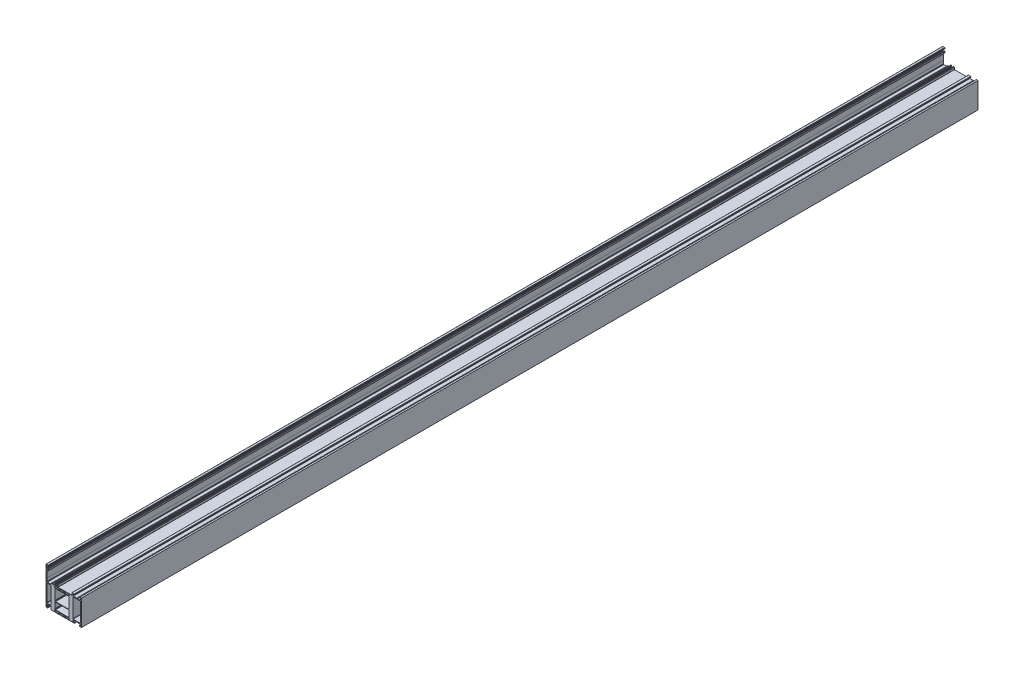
SolidWorks part; units mm, degrees
ref_plane "Ebene vorne" through (0, 0, 0) normal (0, 0, 1) x (1, 0, 0)
ref_plane "Ebene oben" through (0, 0, 0) normal (0, 1, 0) x (1, 0, 0)
ref_plane "Ebene rechts" through (0, 0, 0) normal (1, 0, 0) x (0, 0, -1)
sketch "Skizze1" plane through (0, 0, 0) normal (0, 0, 1) x (1, 0, 0)
  line L0 (15.4, 49) -> (16.2002, 49.0012)
  line L5 (1.85, 45.533) -> (1.9706, 45.583)
  line L6 (28.9408, 47.4176) -> (28.9038, 47.3119)
  line L7 (25.3003, 49.0607) -> (25.3415, 49.0285)
  line L8 (25.3415, 49.0285) -> (25.3896, 49.0079)
  line L9 (25.3896, 49.0079) -> (25.4414, 49.0001)
  line L10 (18.5413, 47.7007) -> (18.43, 47.6881)
  line L11 (47.2413, 44.1006) -> (20.2413, 44.1006)
  line L12 (20.2413, 44.1006) -> (19.9075, 44.063)
  line L13 (19.9075, 44.063) -> (19.5905, 43.9521)
  line L14 (19.5905, 43.9521) -> (19.3061, 43.7734)
  line L15 (19.3061, 43.7734) -> (19.0685, 43.5359)
  line L16 (19.0685, 43.5359) -> (18.8898, 43.2515)
  line L17 (18.8898, 43.2515) -> (18.7789, 42.9344)
  line L18 (18.7789, 42.9344) -> (18.7413, 42.6006)
  line L19 (18.7413, 42.6006) -> (18.7413, 21.6006)
  line L20 (1.6, 27) -> (1.6, 8.9)
  line L21 (1.6, 8.9) -> (1.6125, 8.7888)
  line L22 (1.6125, 8.7888) -> (1.6495, 8.6831)
  line L23 (1.6495, 8.6831) -> (1.7091, 8.5883)
  line L24 (1.7091, 8.5883) -> (1.7883, 8.5091)
  line L25 (1.7883, 8.5091) -> (1.8831, 8.4495)
  line L26 (1.8831, 8.4495) -> (1.9887, 8.4125)
  line L27 (1.9887, 8.4125) -> (2.1, 8.4)
  line L28 (2.1, 8.4) -> (10.3, 8.4)
  line L29 (10.3, 8.4) -> (10.4113, 8.4125)
  line L30 (10.4113, 8.4125) -> (10.5169, 8.4495)
  line L31 (10.5169, 8.4495) -> (10.6117, 8.5091)
  line L32 (10.6117, 8.5091) -> (10.6909, 8.5883)
  line L33 (10.6909, 8.5883) -> (10.7505, 8.6831)
  line L34 (10.7505, 8.6831) -> (10.7875, 8.7888)
  line L35 (10.7875, 8.7888) -> (10.8, 8.9)
  line L36 (10.8, 8.9) -> (10.8, 45.1)
  line L37 (10.8, 45.1) -> (10.7875, 45.2113)
  line L38 (10.7875, 45.2113) -> (10.7505, 45.317)
  line L39 (10.7505, 45.317) -> (10.6909, 45.4118)
  line L40 (10.6909, 45.4118) -> (10.6117, 45.4909)
  line L41 (10.6117, 45.4909) -> (10.5169, 45.5505)
  line L42 (10.5169, 45.5505) -> (10.4113, 45.5875)
  line L43 (10.4113, 45.5875) -> (10.3, 45.6)
  line L44 (10.3, 45.6) -> (2.1, 45.6)
  line L45 (2.1, 45.6) -> (1.9706, 45.583)
  line L46 (1.9706, 45.583) -> (1.85, 45.533)
  line L47 (1.85, 45.533) -> (1.7465, 45.4536)
  line L48 (1.7465, 45.4536) -> (1.667, 45.35)
  line L49 (1.667, 45.35) -> (1.617, 45.2294)
  line L50 (1.617, 45.2294) -> (1.6, 45.1)
  line L51 (1.6, 45.1) -> (1.6, 27)
  line L52 (0, 0) -> (0, 39.25)
  line L53 (0, 39.25) -> (0, 78.5)
  line L54 (0, 78.5) -> (0.0125, 78.6113)
  line L55 (0.0125, 78.6113) -> (0.0495, 78.7169)
  line L56 (0.0495, 78.7169) -> (0.1091, 78.8117)
  line L57 (0.1091, 78.8117) -> (0.1883, 78.8909)
  line L58 (0.1883, 78.8909) -> (0.2831, 78.9505)
  line L59 (0.2831, 78.9505) -> (0.3887, 78.9875)
  line L60 (0.3887, 78.9875) -> (0.5, 79)
  line L61 (0.5, 79) -> (4.5, 79)
  line L62 (4.5, 79) -> (4.6113, 78.9875)
  line L63 (4.6113, 78.9875) -> (4.7169, 78.9505)
  line L64 (4.7169, 78.9505) -> (4.8117, 78.8909)
  line L65 (4.8117, 78.8909) -> (4.8909, 78.8117)
  line L66 (4.8909, 78.8117) -> (4.9505, 78.7169)
  line L67 (4.9505, 78.7169) -> (4.9875, 78.6113)
  line L68 (4.9875, 78.6113) -> (5, 78.5)
  line L69 (5, 78.5) -> (5, 77.2)
  line L70 (5, 77.2) -> (4.9875, 77.0887)
  line L71 (4.9875, 77.0887) -> (4.9505, 76.983)
  line L72 (4.9505, 76.983) -> (4.8909, 76.8882)
  line L73 (4.8909, 76.8882) -> (4.8117, 76.8091)
  line L74 (4.8117, 76.8091) -> (4.7169, 76.7495)
  line L75 (4.7169, 76.7495) -> (4.6113, 76.7125)
  line L76 (4.6113, 76.7125) -> (4.5, 76.7)
  line L77 (4.5, 76.7) -> (4, 76.7)
  line L78 (4, 76.7) -> (4, 77.7)
  line L79 (4, 77.7) -> (2.3, 77.7)
  line L80 (2.3, 77.7) -> (2.0412, 77.6659)
  line L81 (2.0412, 77.6659) -> (1.8, 77.566)
  line L82 (1.8, 77.566) -> (1.5929, 77.4071)
  line L83 (1.5929, 77.4071) -> (1.434, 77.2)
  line L84 (1.434, 77.2) -> (1.3341, 76.9588)
  line L85 (1.3341, 76.9588) -> (1.3, 76.7)
  line L86 (1.3, 76.7) -> (1.3, 72.7)
  line L87 (1.3, 72.7) -> (1.3251, 72.4775)
  line L88 (1.3251, 72.4775) -> (1.399, 72.2661)
  line L89 (1.399, 72.2661) -> (1.5182, 72.0765)
  line L90 (1.5182, 72.0765) -> (1.6765, 71.9182)
  line L91 (1.6765, 71.9182) -> (1.8661, 71.799)
  line L92 (1.8661, 71.799) -> (2.0775, 71.7251)
  line L93 (2.0775, 71.7251) -> (2.3, 71.7)
  line L94 (2.3, 71.7) -> (4, 71.7)
  line L95 (4, 71.7) -> (4, 72.7)
  line L96 (4, 72.7) -> (4.5, 72.7)
  line L97 (4.5, 72.7) -> (4.6294, 72.683)
  line L98 (4.6294, 72.683) -> (4.75, 72.633)
  line L99 (4.75, 72.633) -> (4.8535, 72.5536)
  line L100 (4.8535, 72.5536) -> (4.933, 72.45)
  line L101 (4.933, 72.45) -> (4.983, 72.3294)
  line L102 (4.983, 72.3294) -> (5, 72.2)
  line L103 (5, 72.2) -> (5, 69.4)
  line L104 (5, 69.4) -> (4.9875, 69.2887)
  line L105 (4.9875, 69.2887) -> (4.9505, 69.1831)
  line L106 (4.9505, 69.1831) -> (4.8909, 69.0882)
  line L107 (4.8909, 69.0882) -> (4.8117, 69.0091)
  line L108 (4.8117, 69.0091) -> (4.7169, 68.9495)
  line L109 (4.7169, 68.9495) -> (4.6113, 68.9125)
  line L110 (4.6113, 68.9125) -> (4.5, 68.9)
  line L111 (4.5, 68.9) -> (4.3, 68.9)
  line L112 (4.3, 68.9) -> (4.1887, 68.9125)
  line L113 (4.1887, 68.9125) -> (4.0831, 68.9495)
  line L114 (4.0831, 68.9495) -> (3.9883, 69.0091)
  line L115 (3.9883, 69.0091) -> (3.9091, 69.0882)
  line L116 (3.9091, 69.0882) -> (3.8495, 69.1831)
  line L117 (3.8495, 69.1831) -> (3.8125, 69.2887)
  line L118 (3.8125, 69.2887) -> (3.8, 69.4)
  line L119 (3.8, 69.4) -> (3.8, 69.9)
  line L120 (3.8, 69.9) -> (3.783, 70.0294)
  line L121 (3.783, 70.0294) -> (3.733, 70.15)
  line L122 (3.733, 70.15) -> (3.6536, 70.2535)
  line L123 (3.6536, 70.2535) -> (3.55, 70.333)
  line L124 (3.55, 70.333) -> (3.4294, 70.383)
  line L125 (3.4294, 70.383) -> (3.3, 70.4)
  line L126 (3.3, 70.4) -> (2.1, 70.4)
  line L127 (2.1, 70.4) -> (1.9887, 70.3875)
  line L128 (1.9887, 70.3875) -> (1.8831, 70.3505)
  line L129 (1.8831, 70.3505) -> (1.7883, 70.2909)
  line L130 (1.7883, 70.2909) -> (1.7091, 70.2117)
  line L131 (1.7091, 70.2117) -> (1.6495, 70.1169)
  line L132 (1.6495, 70.1169) -> (1.6125, 70.0113)
  line L133 (1.6125, 70.0113) -> (1.6, 69.9)
  line L134 (1.6, 69.9) -> (1.6, 54)
  line L135 (1.6, 54) -> (1.9461, 47.943)
  line L136 (1.9461, 47.943) -> (1.992, 47.6956)
  line L137 (1.992, 47.6956) -> (2.0981, 47.4674)
  line L138 (2.0981, 47.4674) -> (2.2578, 47.273)
  line L139 (2.2578, 47.273) -> (2.461, 47.1246)
  line L140 (2.461, 47.1246) -> (2.6949, 47.0317)
  line L141 (2.6949, 47.0317) -> (2.9445, 47)
  line L142 (2.9445, 47) -> (10.1, 47)
  line L143 (10.1, 47) -> (10.2294, 47.017)
  line L144 (10.2294, 47.017) -> (10.35, 47.067)
  line L145 (10.35, 47.067) -> (10.4536, 47.1464)
  line L146 (10.4536, 47.1464) -> (10.533, 47.25)
  line L147 (10.533, 47.25) -> (10.583, 47.3706)
  line L148 (10.583, 47.3706) -> (10.6, 47.5)
  line L149 (10.6, 47.5) -> (10.6, 48.5)
  line L150 (10.6, 48.5) -> (10.6125, 48.6113)
  line L151 (10.6125, 48.6113) -> (10.6495, 48.7169)
  line L152 (10.6495, 48.7169) -> (10.7091, 48.8117)
  line L153 (10.7091, 48.8117) -> (10.7883, 48.8909)
  line L154 (10.7883, 48.8909) -> (10.8831, 48.9505)
  line L155 (10.8831, 48.9505) -> (10.9887, 48.9875)
  line L156 (10.9887, 48.9875) -> (11.1, 49)
  line L157 (11.1, 49) -> (12.5, 49)
  line L158 (12.5, 49) -> (12.5294, 48.9337)
  line L159 (12.5294, 48.9337) -> (12.5749, 48.8772)
  line L160 (12.5749, 48.8772) -> (12.6335, 48.8343)
  line L161 (12.6335, 48.8343) -> (12.7011, 48.808)
  line L162 (12.7011, 48.808) -> (12.7732, 48.8)
  line L163 (12.7732, 48.8) -> (13.2268, 48.8)
  line L164 (13.2268, 48.8) -> (13.2989, 48.808)
  line L165 (13.2989, 48.808) -> (13.3665, 48.8343)
  line L166 (13.3665, 48.8343) -> (13.4251, 48.8772)
  line L167 (13.4251, 48.8772) -> (13.4706, 48.9337)
  line L168 (13.4706, 48.9337) -> (13.5, 49)
  line L169 (13.5, 49) -> (15.4, 49)
  line L273 (15.3998, 0.1999) -> (13.4999, 0.1999)
  line L274 (13.4999, 0.1999) -> (13.4705, 0.2662)
  line L275 (13.4705, 0.2662) -> (13.4249, 0.3227)
  line L276 (13.4249, 0.3227) -> (13.3664, 0.3656)
  line L277 (13.3664, 0.3656) -> (13.2988, 0.3919)
  line L278 (13.2988, 0.3919) -> (13.2266, 0.3999)
  line L279 (13.2266, 0.3999) -> (12.7731, 0.3999)
  line L280 (12.7731, 0.3999) -> (12.701, 0.3919)
  line L281 (12.701, 0.3919) -> (12.6334, 0.3656)
  line L282 (12.6334, 0.3656) -> (12.5749, 0.3228)
  line L283 (12.5749, 0.3228) -> (12.5295, 0.2663)
  line L284 (12.5295, 0.2663) -> (12.5001, 0.2)
  line L285 (12.5001, 0.2) -> (11, 0.2)
  line L286 (11, 0.2) -> (10.8887, 0.2125)
  line L287 (10.8887, 0.2125) -> (10.7831, 0.2495)
  line L288 (10.7831, 0.2495) -> (10.6883, 0.3091)
  line L289 (10.6883, 0.3091) -> (10.6091, 0.3883)
  line L290 (10.6091, 0.3883) -> (10.5495, 0.4831)
  line L291 (10.5495, 0.4831) -> (10.5125, 0.5888)
  line L292 (10.5125, 0.5888) -> (10.5, 0.7)
  line L293 (10.5, 0.7) -> (10.5, 6.5)
  line L294 (10.5, 6.5) -> (10.4875, 6.6113)
  line L295 (10.4875, 6.6113) -> (10.4505, 6.7169)
  line L296 (10.4505, 6.7169) -> (10.3909, 6.8117)
  line L297 (10.3909, 6.8117) -> (10.3117, 6.8909)
  line L298 (10.3117, 6.8909) -> (10.2169, 6.9505)
  line L299 (10.2169, 6.9505) -> (10.1113, 6.9875)
  line L300 (10.1113, 6.9875) -> (10, 7)
  line L301 (10, 7) -> (2.8, 7)
  line L302 (2.8, 7) -> (2.5412, 6.9659)
  line L303 (2.5412, 6.9659) -> (2.3, 6.866)
  line L304 (2.3, 6.866) -> (2.0929, 6.7071)
  line L305 (2.0929, 6.7071) -> (1.934, 6.5)
  line L306 (1.934, 6.5) -> (1.8341, 6.2588)
  line L307 (1.8341, 6.2588) -> (1.8, 6)
  line L308 (1.8, 6) -> (1.8, 2.7)
  line L309 (1.8, 2.7) -> (1.8251, 2.4775)
  line L310 (1.8251, 2.4775) -> (1.899, 2.2661)
  line L311 (1.899, 2.2661) -> (2.0182, 2.0765)
  line L312 (2.0182, 2.0765) -> (2.1765, 1.9182)
  line L313 (2.1765, 1.9182) -> (2.3661, 1.799)
  line L314 (2.3661, 1.799) -> (2.5775, 1.7251)
  line L315 (2.5775, 1.7251) -> (2.8, 1.7)
  line L316 (2.8, 1.7) -> (4.5, 1.7)
  line L317 (4.5, 1.7) -> (4.5, 1.1)
  line L318 (4.5, 1.1) -> (3.4, 0)
  line L319 (3.4, 0) -> (0, 0)
  line L320 (29.04, 45.5493) -> (29.0795, 45.5097)
  line L321 (29.0795, 45.5097) -> (29.1743, 45.4502)
  line L322 (29.1743, 45.4502) -> (29.28, 45.4132)
  line L323 (29.28, 45.4132) -> (29.3913, 45.4006)
  line L324 (29.3913, 45.4006) -> (38.0913, 45.4006)
  line L325 (38.0913, 45.4006) -> (38.2207, 45.4177)
  line L326 (38.2207, 45.4177) -> (38.3413, 45.4676)
  line L327 (38.3413, 45.4676) -> (38.4448, 45.5471)
  line L328 (38.4448, 45.5471) -> (38.5243, 45.6506)
  line L329 (38.5243, 45.6506) -> (38.5743, 45.7712)
  line L330 (38.5743, 45.7712) -> (38.5913, 45.9006)
  line L331 (38.5913, 45.9006) -> (38.5913, 47.2007)
  line L332 (38.5913, 47.2007) -> (38.5788, 47.3119)
  line L333 (38.5788, 47.3119) -> (38.5418, 47.4176)
  line L334 (38.5418, 47.4176) -> (38.4822, 47.5124)
  line L335 (38.4822, 47.5124) -> (38.403, 47.5916)
  line L336 (38.403, 47.5916) -> (38.3082, 47.6511)
  line L337 (38.3082, 47.6511) -> (38.2026, 47.6881)
  line L338 (38.2026, 47.6881) -> (38.0913, 47.7007)
  line L339 (38.0913, 47.7007) -> (29.3913, 47.7007)
  line L340 (29.3913, 47.7007) -> (29.28, 47.6881)
  line L341 (29.28, 47.6881) -> (29.1743, 47.6511)
  line L342 (29.1743, 47.6511) -> (29.0795, 47.5916)
  line L343 (29.0795, 47.5916) -> (29.0004, 47.5124)
  line L344 (29.0004, 47.5124) -> (28.9408, 47.4176)
  line L345 (28.9408, 47.4176) -> (28.9038, 47.3119)
  line L346 (28.9038, 47.3119) -> (28.8913, 47.2007)
  line L347 (28.8913, 47.2007) -> (28.8913, 45.9006)
  line L348 (28.8913, 45.9006) -> (28.9038, 45.7894)
  line L349 (28.9038, 45.7894) -> (28.9408, 45.6837)
  line L350 (28.9408, 45.6837) -> (29.0004, 45.5889)
  line L351 (29.0004, 45.5889) -> (29.04, 45.5493)
  line L352 (22.9663, 47.7007) -> (18.5413, 47.7007)
  line L353 (18.5413, 47.7007) -> (18.43, 47.6881)
  line L354 (18.43, 47.6881) -> (18.3243, 47.6511)
  line L355 (18.3243, 47.6511) -> (18.2295, 47.5916)
  line L356 (18.2295, 47.5916) -> (18.1504, 47.5124)
  line L357 (18.1504, 47.5124) -> (18.0908, 47.4176)
  line L358 (18.0908, 47.4176) -> (18.0538, 47.3119)
  line L359 (18.0538, 47.3119) -> (18.0413, 47.2007)
  line L360 (18.0413, 47.2007) -> (18.0413, 45.9007)
  line L361 (18.0413, 45.9007) -> (18.0538, 45.7894)
  line L362 (18.0538, 45.7894) -> (18.0908, 45.6837)
  line L363 (18.0908, 45.6837) -> (18.1504, 45.5889)
  line L364 (18.1504, 45.5889) -> (18.2296, 45.5097)
  line L365 (18.2296, 45.5097) -> (18.3244, 45.4502)
  line L366 (18.3244, 45.4502) -> (18.43, 45.4132)
  line L367 (18.43, 45.4132) -> (18.5413, 45.4006)
  line L368 (18.5413, 45.4006) -> (27.3913, 45.4006)
  line L369 (27.3913, 45.4006) -> (27.4469, 45.4069)
  line L370 (27.4469, 45.4069) -> (27.5025, 45.4132)
  line L371 (27.5025, 45.4132) -> (27.6082, 45.4502)
  line L372 (27.6082, 45.4502) -> (27.703, 45.5097)
  line L373 (27.703, 45.5097) -> (27.7822, 45.5889)
  line L374 (27.7822, 45.5889) -> (27.8418, 45.6837)
  line L375 (27.8418, 45.6837) -> (27.8788, 45.7894)
  line L376 (27.8788, 45.7894) -> (27.8913, 45.9006)
  line L377 (27.8913, 45.9006) -> (27.8913, 47.2006)
  line L378 (27.8913, 47.2006) -> (27.8788, 47.3119)
  line L379 (27.8788, 47.3119) -> (27.8418, 47.4176)
  line L380 (27.8418, 47.4176) -> (27.7822, 47.5124)
  line L381 (27.7822, 47.5124) -> (27.703, 47.5916)
  line L382 (27.703, 47.5916) -> (27.6082, 47.6511)
  line L383 (27.6082, 47.6511) -> (27.5026, 47.6881)
  line L384 (27.5026, 47.6881) -> (27.3913, 47.7007)
  line L385 (27.3913, 47.7007) -> (22.9663, 47.7007)
  line L386 (25.4414, 49.0001) -> (38.362, 49.0001)
  line L387 (38.362, 49.0001) -> (44.8224, 49.0001)
  line L388 (44.8224, 49.0001) -> (52.1201, 49.0001)
  line L424 (47.2451, 44.1002) -> (33.7413, 44.1006)
  line L460 (16.2002, 49.0012) -> (17.0413, 49.0025)
  line L461 (17.0413, 49.0025) -> (17.0858, 49.0075)
  line L462 (17.0858, 49.0075) -> (17.1281, 49.0223)
  line L463 (17.1281, 49.0223) -> (17.166, 49.0462)
  line L464 (17.166, 49.0462) -> (17.1977, 49.0778)
  line L465 (17.1977, 49.0778) -> (17.2215, 49.1158)
  line L466 (17.2215, 49.1158) -> (17.2363, 49.158)
  line L467 (17.2363, 49.158) -> (17.2413, 49.2025)
  line L468 (17.2413, 49.2025) -> (17.2413, 53.3025)
  line L469 (17.2413, 53.3025) -> (17.2538, 53.4138)
  line L470 (17.2538, 53.4138) -> (17.2908, 53.5195)
  line L471 (17.2908, 53.5195) -> (17.3504, 53.6143)
  line L472 (17.3504, 53.6143) -> (17.4296, 53.6935)
  line L473 (17.4296, 53.6935) -> (17.5244, 53.753)
  line L474 (17.5244, 53.753) -> (17.63, 53.79)
  line L475 (17.63, 53.79) -> (17.7413, 53.8025)
  line L476 (17.7413, 53.8025) -> (18.572, 53.8025)
  line L477 (18.572, 53.8025) -> (18.8309, 53.7685)
  line L478 (18.8309, 53.7685) -> (19.072, 53.6686)
  line L479 (19.072, 53.6686) -> (19.2792, 53.5096)
  line L480 (19.2792, 53.5096) -> (19.4381, 53.3025)
  line L481 (19.4381, 53.3025) -> (19.538, 53.0614)
  line L482 (19.538, 53.0614) -> (19.7413, 52.3025)
  line L483 (19.7413, 52.3025) -> (18.7413, 52.3025)
  line L484 (18.7413, 52.3025) -> (18.7413, 50.0025)
  line L485 (18.7413, 50.0025) -> (18.7757, 49.7436)
  line L486 (18.7757, 49.7436) -> (18.8757, 49.5024)
  line L487 (18.8757, 49.5024) -> (19.0346, 49.2951)
  line L488 (19.0346, 49.2951) -> (19.2415, 49.1357)
  line L489 (19.2415, 49.1357) -> (19.4825, 49.0351)
  line L490 (19.4825, 49.0351) -> (19.7413, 49.0001)
  line L491 (19.7413, 49.0001) -> (22.7412, 49.0001)
  line L492 (22.7412, 49.0001) -> (23, 49.0351)
  line L493 (23, 49.0351) -> (23.2411, 49.1357)
  line L494 (23.2411, 49.1357) -> (23.448, 49.295)
  line L495 (23.448, 49.295) -> (23.6069, 49.5024)
  line L496 (23.6069, 49.5024) -> (23.7069, 49.7436)
  line L497 (23.7069, 49.7436) -> (23.7413, 50.0025)
  line L498 (23.7413, 50.0025) -> (23.7413, 52.3025)
  line L499 (23.7413, 52.3025) -> (22.7413, 52.3025)
  line L500 (22.7413, 52.3025) -> (22.9446, 53.0614)
  line L501 (22.9446, 53.0614) -> (23.0445, 53.3025)
  line L502 (23.0445, 53.3025) -> (23.2034, 53.5096)
  line L503 (23.2034, 53.5096) -> (23.4105, 53.6686)
  line L504 (23.4105, 53.6686) -> (23.6517, 53.7685)
  line L505 (23.6517, 53.7685) -> (23.9105, 53.8025)
  line L506 (23.9105, 53.8025) -> (24.7413, 53.8025)
  line L507 (24.7413, 53.8025) -> (24.8526, 53.79)
  line L508 (24.8526, 53.79) -> (24.9582, 53.753)
  line L509 (24.9582, 53.753) -> (25.053, 53.6934)
  line L510 (25.053, 53.6934) -> (25.1322, 53.6143)
  line L511 (25.1322, 53.6143) -> (25.1918, 53.5195)
  line L512 (25.1918, 53.5195) -> (25.2288, 53.4138)
  line L513 (25.2288, 53.4138) -> (25.2413, 53.3025)
  line L514 (25.2413, 53.3025) -> (25.2413, 49.2025)
  line L515 (25.2413, 49.2025) -> (25.2484, 49.1507)
  line L516 (25.2484, 49.1507) -> (25.2685, 49.1024)
  line L517 (25.2685, 49.1024) -> (25.3003, 49.0607)
  line L518 (25.3003, 49.0607) -> (25.4414, 49.0001)
  line L519 (48.7414, 17.5996) -> (48.7414, 6.5996)
  line L520 (48.7414, 6.5996) -> (48.7038, 6.2658)
  line L521 (48.7038, 6.2658) -> (48.5929, 5.9487)
  line L522 (48.5929, 5.9487) -> (48.4142, 5.6643)
  line L523 (48.4142, 5.6643) -> (48.1766, 5.4268)
  line L524 (48.1766, 5.4268) -> (47.8922, 5.2481)
  line L525 (47.8922, 5.2481) -> (47.5752, 5.1372)
  line L526 (47.5752, 5.1372) -> (47.2414, 5.0996)
  line L527 (47.2414, 5.0996) -> (20.2414, 5.0996)
  line L528 (20.2414, 5.0996) -> (19.9076, 5.1372)
  line L529 (19.9076, 5.1372) -> (19.5906, 5.2481)
  line L530 (19.5906, 5.2481) -> (19.3062, 5.4268)
  line L531 (19.3062, 5.4268) -> (19.0687, 5.6643)
  line L532 (19.0687, 5.6643) -> (18.89, 5.9487)
  line L533 (18.89, 5.9487) -> (18.779, 6.2658)
  line L534 (18.779, 6.2658) -> (18.7414, 6.5996)
  line L535 (18.7414, 6.5996) -> (18.7414, 17.5996)
  line L536 (18.7414, 17.5996) -> (18.779, 17.9334)
  line L537 (18.779, 17.9334) -> (18.89, 18.2504)
  line L538 (18.89, 18.2504) -> (19.0687, 18.5348)
  line L539 (19.0687, 18.5348) -> (19.3062, 18.7723)
  line L540 (19.3062, 18.7723) -> (19.5906, 18.951)
  line L541 (19.5906, 18.951) -> (19.9076, 19.062)
  line L542 (19.9076, 19.062) -> (20.2414, 19.0996)
  line L543 (20.2414, 19.0996) -> (47.2414, 19.0996)
  line L544 (47.2414, 19.0996) -> (47.5752, 19.062)
  line L545 (47.5752, 19.062) -> (47.8922, 18.951)
  line L546 (47.8922, 18.951) -> (48.1766, 18.7723)
  line L547 (48.1766, 18.7723) -> (48.4142, 18.5348)
  line L548 (48.4142, 18.5348) -> (48.5929, 18.2504)
  line L549 (48.5929, 18.2504) -> (48.7038, 17.9334)
  line L550 (48.7038, 17.9334) -> (48.7414, 17.5996)
  line L551 (38.3084, 3.75) -> (38.2027, 3.787)
  line L553 (27.6084, 3.75) -> (27.5027, 3.787)
  line L554 (39.6408, 47.4176) -> (39.6038, 47.3119)
  line L555 (47.5751, 44.063) -> (47.2413, 44.1006)
  line L556 (18.7413, 21.6006) -> (18.7789, 21.2669)
  line L557 (18.7789, 21.2669) -> (18.8898, 20.9498)
  line L558 (18.8898, 20.9498) -> (19.0685, 20.6654)
  line L559 (19.0685, 20.6654) -> (19.3061, 20.4279)
  line L560 (19.3061, 20.4279) -> (19.5905, 20.2492)
  line L561 (19.5905, 20.2492) -> (19.9075, 20.1382)
  line L562 (19.9075, 20.1382) -> (20.2413, 20.1006)
  line L563 (20.2413, 20.1006) -> (47.2413, 20.1006)
  line L564 (47.2413, 20.1006) -> (47.5751, 20.1382)
  line L565 (47.5751, 20.1382) -> (47.8921, 20.2492)
  line L566 (47.8921, 20.2492) -> (48.1765, 20.4279)
  line L567 (48.1765, 20.4279) -> (48.414, 20.6654)
  line L568 (48.414, 20.6654) -> (48.5927, 20.9498)
  line L569 (48.5927, 20.9498) -> (48.7037, 21.2669)
  line L570 (48.7037, 21.2669) -> (48.7413, 21.6006)
  line L571 (48.7413, 21.6006) -> (48.7413, 42.6006)
  line L572 (48.7413, 42.6006) -> (48.7037, 42.9344)
  line L573 (48.7037, 42.9344) -> (48.5927, 43.2515)
  line L574 (48.5927, 43.2515) -> (48.414, 43.5359)
  line L575 (48.414, 43.5359) -> (48.1765, 43.7734)
  line L576 (48.1765, 43.7734) -> (47.8921, 43.9521)
  line L577 (47.8921, 43.9521) -> (47.5751, 44.063)
  line L578 (73.3998, 27) -> (73.3998, 47)
  line L579 (73.3998, 47) -> (73.3828, 47.1294)
  line L580 (73.3828, 47.1294) -> (73.3328, 47.25)
  line L581 (73.3328, 47.25) -> (73.2534, 47.3535)
  line L582 (73.2534, 47.3535) -> (73.1498, 47.433)
  line L583 (73.1498, 47.433) -> (73.0292, 47.4829)
  line L584 (73.0292, 47.4829) -> (72.8998, 47.5)
  line L585 (72.8998, 47.5) -> (57.1998, 47.5)
  line L586 (57.1998, 47.5) -> (57.0704, 47.4829)
  line L587 (57.0704, 47.4829) -> (56.9498, 47.433)
  line L588 (56.9498, 47.433) -> (56.8463, 47.3535)
  line L589 (56.8463, 47.3535) -> (56.7668, 47.25)
  line L590 (56.7668, 47.25) -> (56.7169, 47.1294)
  line L591 (56.7169, 47.1294) -> (56.6998, 47)
  line L592 (56.6998, 47) -> (56.6998, 7.0001)
  line L593 (56.6998, 7.0001) -> (56.7169, 6.8707)
  line L594 (56.7169, 6.8707) -> (56.7668, 6.7501)
  line L595 (56.7668, 6.7501) -> (56.8463, 6.6465)
  line L596 (56.8463, 6.6465) -> (56.9498, 6.5671)
  line L597 (56.9498, 6.5671) -> (57.0704, 6.5171)
  line L598 (57.0704, 6.5171) -> (57.1998, 6.5001)
  line L599 (57.1998, 6.5001) -> (72.8998, 6.5001)
  line L600 (72.8998, 6.5001) -> (73.0292, 6.5171)
  line L601 (73.0292, 6.5171) -> (73.1498, 6.5671)
  line L602 (73.1498, 6.5671) -> (73.2534, 6.6465)
  line L603 (73.2534, 6.6465) -> (73.3328, 6.7501)
  line L604 (73.3328, 6.7501) -> (73.3828, 6.8707)
  line L605 (73.3828, 6.8707) -> (73.3998, 7.0001)
  line L606 (73.3998, 7.0001) -> (73.3998, 27)
  line L607 (74.9998, 54) -> (74.9998, 27)
  line L608 (74.9998, 27) -> (74.9998, 0.0001)
  line L609 (74.9998, 0.0001) -> (71.5998, 0.0001)
  line L610 (71.5998, 0.0001) -> (70.4998, 1.1001)
  line L611 (70.4998, 1.1001) -> (70.4998, 1.7001)
  line L612 (70.4998, 1.7001) -> (72.2998, 1.7001)
  line L613 (72.2998, 1.7001) -> (72.5587, 1.7342)
  line L614 (72.5587, 1.7342) -> (72.7998, 1.8341)
  line L615 (72.7998, 1.8341) -> (73.0069, 1.993)
  line L616 (73.0069, 1.993) -> (73.1658, 2.2001)
  line L617 (73.1658, 2.2001) -> (73.2658, 2.4413)
  line L618 (73.2658, 2.4413) -> (73.2998, 2.7001)
  line L619 (73.2998, 2.7001) -> (73.2998, 4.0001)
  line L620 (73.2998, 4.0001) -> (73.2658, 4.2589)
  line L621 (73.2658, 4.2589) -> (73.1659, 4.5001)
  line L622 (73.1659, 4.5001) -> (73.0069, 4.7072)
  line L623 (73.0069, 4.7072) -> (72.7998, 4.8661)
  line L624 (72.7998, 4.8661) -> (72.5587, 4.966)
  line L625 (72.5587, 4.966) -> (72.2998, 5.0001)
  line L626 (72.2998, 5.0001) -> (65.9998, 5.0001)
  line L627 (65.9998, 5.0001) -> (65.8521, 5.1088)
  line L628 (65.8521, 5.1088) -> (65.6818, 5.1769)
  line L629 (65.6818, 5.1769) -> (65.4998, 5.2001)
  line L630 (65.4998, 5.2001) -> (65.3179, 5.1769)
  line L631 (65.3179, 5.1769) -> (65.1476, 5.1088)
  line L632 (65.1476, 5.1088) -> (64.9998, 5.0001)
  line L633 (64.9998, 5.0001) -> (57.9998, 5.0001)
  line L634 (57.9998, 5.0001) -> (57.7773, 4.975)
  line L635 (57.7773, 4.975) -> (57.5659, 4.901)
  line L636 (57.5659, 4.901) -> (57.3763, 4.7819)
  line L637 (57.3763, 4.7819) -> (57.218, 4.6236)
  line L638 (57.218, 4.6236) -> (57.0988, 4.434)
  line L639 (57.0988, 4.434) -> (57.0249, 4.2226)
  line L640 (57.0249, 4.2226) -> (56.9998, 4.0001)
  line L641 (56.9998, 4.0001) -> (56.9998, 2.7001)
  line L642 (56.9998, 2.7001) -> (57.0339, 2.4413)
  line L643 (57.0339, 2.4413) -> (57.1338, 2.2001)
  line L644 (57.1338, 2.2001) -> (57.2927, 1.993)
  line L645 (57.2927, 1.993) -> (57.4998, 1.8341)
  line L646 (57.4998, 1.8341) -> (57.741, 1.7342)
  line L647 (57.741, 1.7342) -> (57.9998, 1.7001)
  line L648 (57.9998, 1.7001) -> (60.4998, 1.7001)
  line L649 (60.4998, 1.7001) -> (60.4998, 1.2001)
  line L650 (60.4998, 1.2001) -> (60.4657, 0.9413)
  line L651 (60.4657, 0.9413) -> (60.3658, 0.7001)
  line L652 (60.3658, 0.7001) -> (60.2069, 0.493)
  line L653 (60.2069, 0.493) -> (59.9998, 0.3341)
  line L654 (59.9998, 0.3341) -> (59.7586, 0.2342)
  line L655 (59.7586, 0.2342) -> (59.4998, 0.2001)
  line L656 (59.4998, 0.2001) -> (55.0001, 0.2001)
  line L657 (55.0001, 0.2001) -> (54.9708, 0.2664)
  line L658 (54.9708, 0.2664) -> (54.9252, 0.3229)
  line L659 (54.9252, 0.3229) -> (54.8667, 0.3658)
  line L660 (54.8667, 0.3658) -> (54.7991, 0.3921)
  line L661 (54.7991, 0.3921) -> (54.727, 0.4001)
  line L662 (54.727, 0.4001) -> (54.2734, 0.4001)
  line L663 (54.2734, 0.4001) -> (54.2012, 0.3921)
  line L664 (54.2012, 0.3921) -> (54.1336, 0.3658)
  line L665 (54.1336, 0.3658) -> (54.0751, 0.3229)
  line L666 (54.0751, 0.3229) -> (54.0296, 0.2664)
  line L667 (54.0296, 0.2664) -> (54.0002, 0.2001)
  line L668 (54.0002, 0.2001) -> (52.1201, 0.2001)
  line L773 (52.1201, 49.0001) -> (54.0001, 49.0001)
  line L774 (54.0001, 49.0001) -> (54.0295, 48.9338)
  line L775 (54.0295, 48.9338) -> (54.075, 48.8772)
  line L776 (54.075, 48.8772) -> (54.1336, 48.8344)
  line L777 (54.1336, 48.8344) -> (54.2012, 48.8081)
  line L778 (54.2012, 48.8081) -> (54.2733, 48.8001)
  line L779 (54.2733, 48.8001) -> (54.7269, 48.8001)
  line L780 (54.7269, 48.8001) -> (54.7892, 48.8059)
  line L781 (54.7892, 48.8059) -> (54.8487, 48.8254)
  line L782 (54.8487, 48.8254) -> (54.9024, 48.8577)
  line L783 (54.9024, 48.8577) -> (54.9474, 48.9011)
  line L784 (54.9474, 48.9011) -> (54.9817, 48.9535)
  line L785 (54.9817, 48.9535) -> (55.0034, 49.0123)
  line L786 (55.0034, 49.0123) -> (55.0803, 49.0232)
  line L787 (55.0803, 49.0232) -> (55.1519, 49.0536)
  line L788 (55.1519, 49.0536) -> (55.2132, 49.1014)
  line L789 (55.2132, 49.1014) -> (55.2602, 49.1633)
  line L790 (55.2602, 49.1633) -> (55.2898, 49.2352)
  line L791 (55.2898, 49.2352) -> (55.2998, 49.3122)
  line L792 (55.2998, 49.3122) -> (55.2998, 52.3)
  line L793 (55.2998, 52.3) -> (54.4998, 52.3)
  line L794 (54.4998, 52.3) -> (54.4998, 53.3)
  line L795 (54.4998, 53.3) -> (54.5124, 53.4112)
  line L796 (54.5124, 53.4112) -> (54.5493, 53.5169)
  line L797 (54.5493, 53.5169) -> (54.6089, 53.6117)
  line L798 (54.6089, 53.6117) -> (54.6881, 53.6909)
  line L799 (54.6881, 53.6909) -> (54.7829, 53.7505)
  line L800 (54.7829, 53.7505) -> (54.8886, 53.7874)
  line L801 (54.8886, 53.7874) -> (54.9998, 53.8)
  line L802 (54.9998, 53.8) -> (59.4998, 53.8)
  line L803 (59.4998, 53.8) -> (59.7586, 53.7659)
  line L804 (59.7586, 53.7659) -> (59.9998, 53.666)
  line L805 (59.9998, 53.666) -> (60.2069, 53.5071)
  line L806 (60.2069, 53.5071) -> (60.3658, 53.3)
  line L807 (60.3658, 53.3) -> (60.4657, 53.0588)
  line L808 (60.4657, 53.0588) -> (60.4998, 52.8)
  line L809 (60.4998, 52.8) -> (60.4998, 52.3)
  line L810 (60.4998, 52.3) -> (57.9998, 52.3)
  line L811 (57.9998, 52.3) -> (57.741, 52.2659)
  line L812 (57.741, 52.2659) -> (57.4998, 52.166)
  line L813 (57.4998, 52.166) -> (57.2927, 52.0071)
  line L814 (57.2927, 52.0071) -> (57.1338, 51.8)
  line L815 (57.1338, 51.8) -> (57.0339, 51.5588)
  line L816 (57.0339, 51.5588) -> (56.9998, 51.3)
  line L817 (56.9998, 51.3) -> (56.9998, 50)
  line L818 (56.9998, 50) -> (57.0339, 49.7412)
  line L819 (57.0339, 49.7412) -> (57.1338, 49.5)
  line L820 (57.1338, 49.5) -> (57.2927, 49.2929)
  line L821 (57.2927, 49.2929) -> (57.4998, 49.134)
  line L822 (57.4998, 49.134) -> (57.741, 49.0341)
  line L823 (57.741, 49.0341) -> (57.9998, 49)
  line L824 (57.9998, 49) -> (64.9998, 49)
  line L825 (64.9998, 49) -> (65.1476, 48.8913)
  line L826 (65.1476, 48.8913) -> (65.3179, 48.8231)
  line L827 (65.3179, 48.8231) -> (65.4998, 48.7999)
  line L828 (65.4998, 48.7999) -> (65.6818, 48.8231)
  line L829 (65.6818, 48.8231) -> (65.8521, 48.8913)
  line L830 (65.8521, 48.8913) -> (65.9998, 49)
  line L831 (65.9998, 49) -> (72.0003, 49)
  line L832 (72.0003, 49) -> (72.2591, 49.0341)
  line L833 (72.2591, 49.0341) -> (72.5003, 49.134)
  line L834 (72.5003, 49.134) -> (72.7074, 49.2929)
  line L835 (72.7074, 49.2929) -> (72.8663, 49.5)
  line L836 (72.8663, 49.5) -> (72.9662, 49.7412)
  line L837 (72.9662, 49.7412) -> (73.0003, 50)
  line L838 (73.0003, 50) -> (73.0003, 51.3)
  line L839 (73.0003, 51.3) -> (72.9662, 51.5588)
  line L840 (72.9662, 51.5588) -> (72.8663, 51.8)
  line L841 (72.8663, 51.8) -> (72.7074, 52.0071)
  line L842 (72.7074, 52.0071) -> (72.5003, 52.166)
  line L843 (72.5003, 52.166) -> (72.2591, 52.2659)
  line L844 (72.2591, 52.2659) -> (72.0003, 52.3)
  line L845 (72.0003, 52.3) -> (70.4998, 52.3)
  line L846 (70.4998, 52.3) -> (70.4998, 52.9)
  line L847 (70.4998, 52.9) -> (71.5998, 54)
  line L848 (71.5998, 54) -> (74.9998, 54)
  line L849 (48.9969, 47.6944) -> (48.9413, 47.7007)
  line L850 (48.9413, 47.7007) -> (40.0913, 47.7007)
  line L851 (40.0913, 47.7007) -> (39.98, 47.6881)
  line L852 (39.98, 47.6881) -> (39.8743, 47.6511)
  line L853 (39.8743, 47.6511) -> (39.7795, 47.5916)
  line L854 (39.7795, 47.5916) -> (39.7004, 47.5124)
  line L855 (39.7004, 47.5124) -> (39.6408, 47.4176)
  line L856 (39.6408, 47.4176) -> (39.6038, 47.3119)
  line L857 (39.6038, 47.3119) -> (39.5913, 47.2006)
  line L858 (39.5913, 47.2006) -> (39.5913, 45.9006)
  line L859 (39.5913, 45.9006) -> (39.6038, 45.7894)
  line L860 (39.6038, 45.7894) -> (39.6408, 45.6837)
  line L861 (39.6408, 45.6837) -> (39.7004, 45.5889)
  line L862 (39.7004, 45.5889) -> (39.7795, 45.5097)
  line L863 (39.7795, 45.5097) -> (39.8743, 45.4502)
  line L864 (39.8743, 45.4502) -> (39.98, 45.4132)
  line L865 (39.98, 45.4132) -> (40.0913, 45.4006)
  line L866 (40.0913, 45.4006) -> (48.9413, 45.4006)
  line L867 (48.9413, 45.4006) -> (49.0525, 45.4132)
  line L868 (49.0525, 45.4132) -> (49.1582, 45.4502)
  line L869 (49.1582, 45.4502) -> (49.253, 45.5097)
  line L870 (49.253, 45.5097) -> (49.3322, 45.5889)
  line L871 (49.3322, 45.5889) -> (49.3918, 45.6837)
  line L872 (49.3918, 45.6837) -> (49.4288, 45.7894)
  line L873 (49.4288, 45.7894) -> (49.4413, 45.9006)
  line L874 (49.4413, 45.9006) -> (49.4413, 47.2006)
  line L875 (49.4413, 47.2006) -> (49.4288, 47.3119)
  line L876 (49.4288, 47.3119) -> (49.3918, 47.4176)
  line L877 (49.3918, 47.4176) -> (49.3322, 47.5124)
  line L878 (49.3322, 47.5124) -> (49.253, 47.5916)
  line L879 (49.253, 47.5916) -> (49.1582, 47.6511)
  line L880 (49.1582, 47.6511) -> (49.0525, 47.6881)
  line L881 (49.0525, 47.6881) -> (48.9969, 47.6944)
  line L882 (38.147, 3.7933) -> (38.0914, 3.7996)
  line L883 (38.0914, 3.7996) -> (29.3914, 3.7996)
  line L884 (29.3914, 3.7996) -> (29.262, 3.7825)
  line L885 (29.262, 3.7825) -> (29.1414, 3.7326)
  line L886 (29.1414, 3.7326) -> (29.0379, 3.6531)
  line L887 (29.0379, 3.6531) -> (28.9584, 3.5496)
  line L888 (28.9584, 3.5496) -> (28.9084, 3.429)
  line L889 (28.9084, 3.429) -> (28.8914, 3.2996)
  line L890 (28.8914, 3.2996) -> (28.8914, 1.9996)
  line L891 (28.8914, 1.9996) -> (28.9039, 1.8883)
  line L892 (28.9039, 1.8883) -> (28.9409, 1.7826)
  line L893 (28.9409, 1.7826) -> (29.0005, 1.6878)
  line L894 (29.0005, 1.6878) -> (29.0797, 1.6086)
  line L895 (29.0797, 1.6086) -> (29.1745, 1.5491)
  line L896 (29.1745, 1.5491) -> (29.2801, 1.5121)
  line L897 (29.2801, 1.5121) -> (29.3914, 1.4996)
  line L898 (29.3914, 1.4996) -> (38.0914, 1.4996)
  line L899 (38.0914, 1.4996) -> (38.2027, 1.5121)
  line L900 (38.2027, 1.5121) -> (38.3084, 1.5491)
  line L901 (38.3084, 1.5491) -> (38.4032, 1.6086)
  line L902 (38.4032, 1.6086) -> (38.4823, 1.6878)
  line L903 (38.4823, 1.6878) -> (38.5419, 1.7826)
  line L904 (38.5419, 1.7826) -> (38.5789, 1.8883)
  line L905 (38.5789, 1.8883) -> (38.5914, 1.9996)
  line L906 (38.5914, 1.9996) -> (38.5914, 3.2996)
  line L907 (38.5914, 3.2996) -> (38.5789, 3.4108)
  line L908 (38.5789, 3.4108) -> (38.5419, 3.5165)
  line L909 (38.5419, 3.5165) -> (38.4823, 3.6113)
  line L910 (38.4823, 3.6113) -> (38.4032, 3.6905)
  line L911 (38.4032, 3.6905) -> (38.3084, 3.75)
  line L912 (38.3084, 3.75) -> (38.2027, 3.787)
  line L913 (38.2027, 3.787) -> (38.147, 3.7933)
  line L914 (40.0358, 1.5058) -> (40.0914, 1.4996)
  line L915 (40.0914, 1.4996) -> (48.9414, 1.4996)
  line L916 (48.9414, 1.4996) -> (49.0527, 1.5121)
  line L917 (49.0527, 1.5121) -> (49.1584, 1.5491)
  line L918 (49.1584, 1.5491) -> (49.2532, 1.6086)
  line L919 (49.2532, 1.6086) -> (49.3323, 1.6878)
  line L920 (49.3323, 1.6878) -> (49.3919, 1.7826)
  line L921 (49.3919, 1.7826) -> (49.4289, 1.8883)
  line L922 (49.4289, 1.8883) -> (49.4414, 1.9995)
  line L923 (49.4414, 1.9995) -> (49.4414, 3.2995)
  line L924 (49.4414, 3.2995) -> (49.4289, 3.4108)
  line L925 (49.4289, 3.4108) -> (49.3919, 3.5165)
  line L926 (49.3919, 3.5165) -> (49.3323, 3.6113)
  line L927 (49.3323, 3.6113) -> (49.2531, 3.6905)
  line L928 (49.2531, 3.6905) -> (49.1583, 3.75)
  line L929 (49.1583, 3.75) -> (49.0527, 3.787)
  line L930 (49.0527, 3.787) -> (48.9414, 3.7996)
  line L931 (48.9414, 3.7996) -> (40.0914, 3.7996)
  line L932 (40.0914, 3.7996) -> (40.0358, 3.7933)
  line L933 (40.0358, 3.7933) -> (39.9802, 3.787)
  line L934 (39.9802, 3.787) -> (39.8745, 3.75)
  line L935 (39.8745, 3.75) -> (39.7797, 3.6905)
  line L936 (39.7797, 3.6905) -> (39.7005, 3.6113)
  line L937 (39.7005, 3.6113) -> (39.6409, 3.5165)
  line L938 (39.6409, 3.5165) -> (39.604, 3.4108)
  line L939 (39.604, 3.4108) -> (39.5914, 3.2996)
  line L940 (39.5914, 3.2996) -> (39.5914, 1.9996)
  line L941 (39.5914, 1.9996) -> (39.6039, 1.8883)
  line L942 (39.6039, 1.8883) -> (39.6409, 1.7826)
  line L943 (39.6409, 1.7826) -> (39.7005, 1.6878)
  line L944 (39.7005, 1.6878) -> (39.7797, 1.6086)
  line L945 (39.7797, 1.6086) -> (39.8745, 1.5491)
  line L946 (39.8745, 1.5491) -> (39.9802, 1.5121)
  line L947 (39.9802, 1.5121) -> (40.0358, 1.5058)
  line L948 (18.4858, 1.5058) -> (18.5414, 1.4996)
  line L949 (18.5414, 1.4996) -> (27.3914, 1.4996)
  line L950 (27.3914, 1.4996) -> (27.5027, 1.5121)
  line L951 (27.5027, 1.5121) -> (27.6084, 1.5491)
  line L952 (27.6084, 1.5491) -> (27.7032, 1.6086)
  line L953 (27.7032, 1.6086) -> (27.7823, 1.6878)
  line L954 (27.7823, 1.6878) -> (27.8419, 1.7826)
  line L955 (27.8419, 1.7826) -> (27.8789, 1.8883)
  line L956 (27.8789, 1.8883) -> (27.8914, 1.9996)
  line L957 (27.8914, 1.9996) -> (27.8914, 3.2996)
  line L958 (27.8914, 3.2996) -> (27.8789, 3.4108)
  line L959 (27.8789, 3.4108) -> (27.8419, 3.5165)
  line L960 (27.8419, 3.5165) -> (27.7823, 3.6113)
  line L961 (27.7823, 3.6113) -> (27.7032, 3.6905)
  line L962 (27.7032, 3.6905) -> (27.6084, 3.75)
  line L963 (27.6084, 3.75) -> (27.5027, 3.787)
  line L964 (27.5027, 3.787) -> (27.3914, 3.7996)
  line L965 (27.3914, 3.7996) -> (18.5414, 3.7996)
  line L966 (18.5414, 3.7996) -> (18.4302, 3.787)
  line L967 (18.4302, 3.787) -> (18.3245, 3.75)
  line L968 (18.3245, 3.75) -> (18.2297, 3.6905)
  line L969 (18.2297, 3.6905) -> (18.1505, 3.6113)
  line L970 (18.1505, 3.6113) -> (18.0909, 3.5165)
  line L971 (18.0909, 3.5165) -> (18.0539, 3.4108)
  line L972 (18.0539, 3.4108) -> (18.0414, 3.2996)
  line L973 (18.0414, 3.2996) -> (18.0414, 1.9996)
  line L974 (18.0414, 1.9996) -> (18.0539, 1.8883)
  line L975 (18.0539, 1.8883) -> (18.0909, 1.7826)
  line L976 (18.0909, 1.7826) -> (18.1505, 1.6878)
  line L977 (18.1505, 1.6878) -> (18.2297, 1.6086)
  line L978 (18.2297, 1.6086) -> (18.3245, 1.5491)
  line L979 (18.3245, 1.5491) -> (18.4302, 1.5121)
  line L980 (18.4302, 1.5121) -> (18.4858, 1.5058)
  line L981 (52.1201, 0.2001) -> (33.7412, 0.1995)
  line L982 (33.7412, 0.1995) -> (24.9706, 0.1998)
  line L983 (24.9706, 0.1998) -> (15.3998, 0.1999)
  line L1018 (20.2376, 5.1) -> (33.7572, 5.0996)
extrude "Aufsatz-Linear austragen3" add sketch "Skizze1" along normal blind 1895 contours L983 L982 L981 L668 L667 L666 L665 L664 L663 L662 L661 L660 L659 L658 L657 L656 L655 L654 L653 L652 L651 L650 L649 L648 L647 L646 L645 L644 L643 L642 L641 L640 L639 L638 L637 L636 L635 L634 L633 L632 L631 L630 L629 L628 L627 L626 L625 L624 L623 L622 L621
